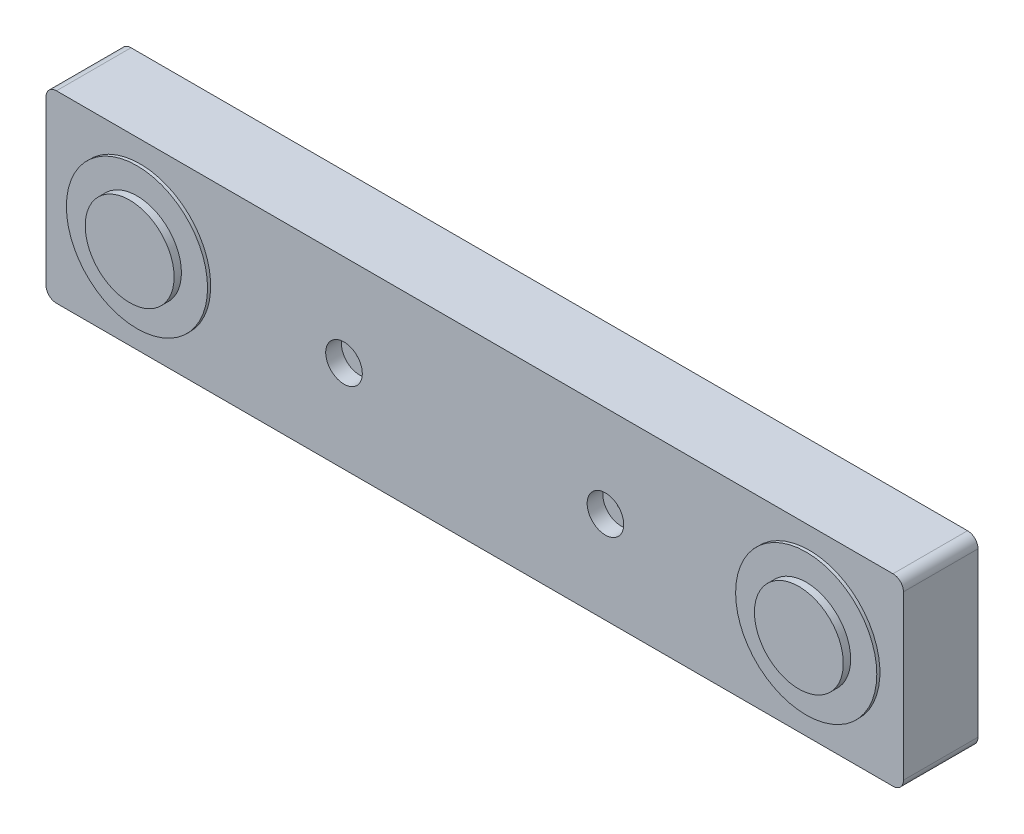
SolidWorks part; units mm, degrees
ref_plane "Front Plane" through (0, 0, 0) normal (0, 0, 1) x (1, 0, 0)
ref_plane "Top Plane" through (0, 0, 0) normal (0, 1, 0) x (1, 0, 0)
ref_plane "Right Plane" through (0, 0, 0) normal (1, 0, 0) x (0, 0, -1)
sketch "Sketch1" plane through (0, 0, 0) normal (0, 0, 1) x (1, 0, 0)
  line L1 (0, 0) -> (93.35, 0)
  line L2 (0, 0) -> (0, 17.6)
  line L3 (0, 17.6) -> (93.35, 17.6)
  line L4 (93.35, 0) -> (93.35, 17.6)
  dimension "D1" = 93.35
  dimension "D2" = 17.6
sketch "Sketch2" plane through (0, 0, 0) normal (0, 0, 1) x (1, 0, 0)
  line L0 (0, 0) -> (93.35, 0) construction
  line L1 (93.35, 17.6) -> (11.35, 17.6)
  line L2 (93.35, 17.6) -> (93.35, 0)
  line L3 (93.35, 0) -> (11.35, 0)
  line L4 (11.35, 17.6) -> (11.35, 0)
  dimension "D1" = 82
extrude "Boss-Extrude1" add sketch "Sketch2" along normal blind 7.13
fillet "Fillet1" radius 1 4 edges at (93.35, 17.6, 3.565) (93.35, 0, 3.565) (11.35, 0, 3.565) (11.35, 17.6, 3.565)
sketch "Sketch3" plane through (11.35, 0, 0) normal (-1, 0, 0) x (0, 0, 1)
  line L0 (7.13, 16.6) -> (0, 16.6) construction
  line L1 (1, 16.6) -> (6.13, 16.6)
  line L2 (1, 16.6) -> (1, 1)
  line L3 (1, 1) -> (6.13, 1)
  line L4 (6.13, 16.6) -> (6.13, 1)
  line L5 (0, 1) -> (7.13, 1) construction
  line L6 (0, 0) -> (0, 17.6) construction
  line L7 (7.13, 16.6) -> (7.13, 1) construction
  dimension "D1" = 1
  dimension "D2" = 1
sketch "Sketch4" plane through (0, 0, 7.13) normal (0, 0, 1) x (1, 0, 0)
  line L0 (93.35, 8.8) -> (-5.3332, 8.8) construction
  line L1 (93.35, 0) -> (93.35, 17.6) construction
  line L2 (52.35, 24.5905) -> (52.35, -7.581) construction
  circle A0 centre (39.85, 8.8) radius 0.4
  circle A1 centre (64.85, 8.8) radius 0.4
  dimension "D2" = 0.8
  dimension "D1" = 41
  dimension "D3" = 12.5
extrude "Cut-Extrude1" cut sketch "Sketch4" against normal through all both and the other way through all
sketch "Sketch5" plane through (0, 0, 7.13) normal (0, 0, 1) x (1, 0, 0)
  circle A0 centre (39.85, 8.8) radius 1.75
  circle A1 centre (64.85, 8.8) radius 1.75
  dimension "D1" = 3.5
  dimension "D2" = 3.5
extrude "Cut-Extrude2" cut sketch "Sketch5" against normal blind 1.5
sketch "Sketch6" plane through (0, 0, 7.13) normal (0, 0, 1) x (1, 0, 0)
  line L0 (52.35, 29.3522) -> (52.35, -12.9) construction
  line L1 (93.35, 0) -> (93.35, 17.6) construction
  line L2 (11.35, 8.8) -> (93.35, 8.8) construction
  line L3 (11.35, 16.6) -> (11.35, 1) construction
  circle A0 centre (20.35, 8.8) radius 4.25
  circle A1 centre (84.35, 8.8) radius 4.25
  dimension "D3" = 8.5
  dimension "D1" = 41
  dimension "D2" = 32
extrude "Boss-Extrude3" add sketch "Sketch6" along normal blind 1
sketch "Sketch7" plane through (0, 0, 7.13) normal (0, 0, 1) x (1, 0, 0)
  circle A0 centre (20.35, 8.8) radius 6.75
  circle A1 centre (84.35, 8.8) radius 6.75
  dimension "D1" = 13.5
  dimension "D2" = 13.5
extrude "Boss-Extrude4" add sketch "Sketch7" along normal blind 0.3
